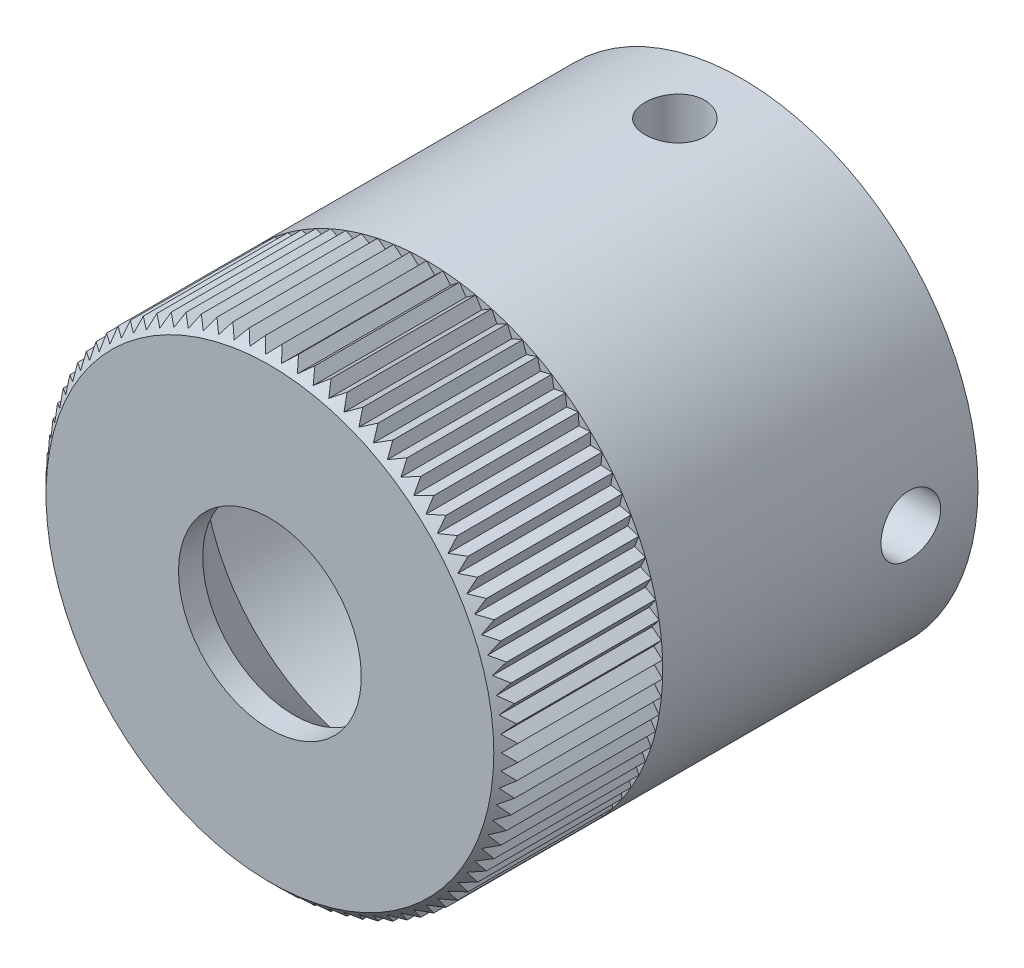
SolidWorks part; units mm, degrees
ref_plane "Front Plane" through (0, 0, 0) normal (0, 0, 1) x (1, 0, 0)
ref_plane "Top Plane" through (0, 0, 0) normal (0, 1, 0) x (1, 0, 0)
ref_plane "Right Plane" through (0, 0, 0) normal (1, 0, 0) x (0, 0, -1)
sketch "Sketch1" plane through (0, 0, 0) normal (0, 0, 1) x (1, 0, 0)
  circle A0 centre (0, 0) radius 6.325
  dimension "D1" = 12.65
extrude "Boss-Extrude1" add sketch "Sketch1" along normal blind 12.65
sketch "Sketch2" plane through (0, 0, 0) normal (0, 0, -1) x (-1, 0, 0)
  circle A0 centre (0, 0) radius 4.8
  dimension "D1" = 9.6
extrude "Cut-Extrude1" cut sketch "Sketch2" against normal blind 9.65
sketch "Sketch3" plane through (0, 0, 9.65) normal (0, 0, -1) x (-1, 0, 0)
  circle A0 centre (0, 0) radius 2.45
  dimension "D1" = 4.9
extrude "Cut-Extrude2" cut sketch "Sketch3" against normal through all
sketch "Sketch4" plane through (0, 0, 9.65) normal (0, 0, -1) x (-1, 0, 0)
  circle A0 centre (0, 0) radius 4.8
  circle A1 centre (0, 0) radius 4.8 construction
extrude "Cut-Extrude3" cut sketch "Sketch4" against normal through all draft 45
sketch "Sketch5" plane through (0, 0, 12.65) normal (0, 0, 1) x (1, 0, 0)
  line L0 (0, 0) -> (0, 6.325) construction
  line L1 (0, 0) -> (0.4412, 6.3096) construction
  line L2 (0, 6.325) -> (0.2129, 6.0967)
  line L3 (0.2129, 6.0967) -> (0.4412, 6.3096)
  circle A0 centre (0, 0) radius 6.325 construction
  arc A1 (0, 6.325) -> (0.4412, 6.3096) centre (0.2283, 6.5379) cw
  dimension "D1" = 4
extrude "Cut-Extrude4" cut sketch "Sketch5" against normal blind 4.2
pattern_circular "CirPattern1" count 90 over 360 about axis through (0, 0, 0) along (0, 0, 1) of "Cut-Extrude4"
chamfer "Chamfer1" distance 0.5 angle 45 1 edges at (-4.8, 0, 0)
sketch "Sketch6" plane through (0, 0, 0) normal (1, 0, 0) x (0, 0, -1)
  circle A0 centre (-1.8, 0) radius 0.8
  point P2 (-1, 0)
  dimension "D2" = 1.6
  dimension "D1" = 1
extrude "Cut-Extrude5" cut sketch "Sketch6" against normal through all both and the other way through all
pattern_circular "CirPattern2" count 2 over 90 about axis through (0, 0, 12.65) along (0, 0, -1) of "Cut-Extrude5"
sketch "Sketch7" plane through (0, 0, 0) normal (1, 0, 0) x (0, 0, -1)
  line L0 (0, -6.325) -> (0, 6.325) construction
  circle A0 centre (-1.8, 4.8) radius 0.8
  dimension "D1" = 1.6
  dimension "D2" = 1.8
  dimension "D3" = 4.8
revolve "Cut-Revolve1" [suppressed] cut sketch "Sketch7" angle 360
sketch "Sketch8" plane through (0, 0, 0) normal (1, 0, 0) x (0, 0, -1)
  line L0 (-2.6, 6.325) -> (-8.45, 6.325) construction
  line L1 (-2.7, 6.325) -> (-1.1, 6.325)
  line L2 (-2.7, 6.325) -> (-2.7, 5.85)
  line L3 (-2.7, 5.85) -> (-1.1, 5.85)
  line L4 (-1.1, 6.325) -> (-1.1, 5.85)
  line L6 (-3.2, 6.325) -> (-4.7, 6.325)
  line L7 (-3.2, 6.325) -> (-3.2, 5.85)
  line L8 (-3.2, 5.85) -> (-4.7, 5.85)
  line L9 (-4.7, 6.325) -> (-4.7, 5.85)
  line L10 (-5.2, 6.325) -> (-6.7, 6.325)
  line L11 (-5.2, 6.325) -> (-5.2, 5.85)
  line L12 (-5.2, 5.85) -> (-6.7, 5.85)
  line L13 (-6.7, 6.325) -> (-6.7, 5.85)
  line L19 (-2.6, 6.325) -> (-8.45, 6.325) construction
  line L24 (-8.7, 6.325) -> (-7.2, 6.325)
  line L25 (-8.7, 6.325) -> (-8.7, 5.85)
  line L26 (-8.7, 5.85) -> (-7.2, 5.85)
  line L27 (-7.2, 6.325) -> (-7.2, 5.85)
  line L28 (0, -6.325) -> (0, 6.325) construction
  line L29 (-9.2, 6.325) -> (-14.2, 6.325)
  line L30 (-9.2, 6.325) -> (-9.2, 5.85)
  line L31 (-9.2, 5.85) -> (-14.2, 5.85)
  line L32 (-14.2, 6.325) -> (-14.2, 5.85)
  line L33 (-14.2, 5.85) -> (-14.2, 0) construction
  line L35 (-14.2, 0) -> (-14.2, -5.85) construction
  line L36 (-9.2, 6.325) -> (-8.7, 6.325) construction
  line L37 (-7.2, 6.325) -> (-6.7, 6.325) construction
  line L38 (-5.2, 6.325) -> (-4.7, 6.325) construction
  line L39 (-3.2, 6.325) -> (-2.7, 6.325) construction
  dimension "D1" = 1.1
  dimension "D2" = 1.6
  dimension "D3" = 9.2
  dimension "D4" = 5
  dimension "D5" = 11.7
  dimension "D6" = 0.5
revolve "Cut-Revolve3" [suppressed] cut sketch "Sketch8" angle 360
sketch "Sketch9" plane through (0, 0, 12.65) normal (0, 0, 1) x (1, 0, 0)
  line L1 (1.4434, 2.5) -> (-1.4434, 2.5)
  line L2 (-1.4434, 2.5) -> (-2.8868, 0)
  line L3 (-2.8868, 0) -> (-1.4434, -2.5)
  line L4 (-1.4434, -2.5) -> (1.4434, -2.5)
  line L5 (1.4434, -2.5) -> (2.8868, 0)
  line L6 (2.8868, 0) -> (1.4434, 2.5)
  circle A0 centre (0, 0) radius 2.5 construction
  dimension "D1" = 5
extrude "Cut-Extrude6" [suppressed] cut sketch "Sketch9" against normal blind 10
sketch "Sketch10" plane through (0, 0, 12.65) normal (0, 0, 1) x (1, 0, 0)
  circle A0 centre (0, 0) radius 6
  dimension "D1" = 12
extrude "Cut-Extrude7" cut sketch "Sketch10" against normal through all draft 45 flip side to cut
